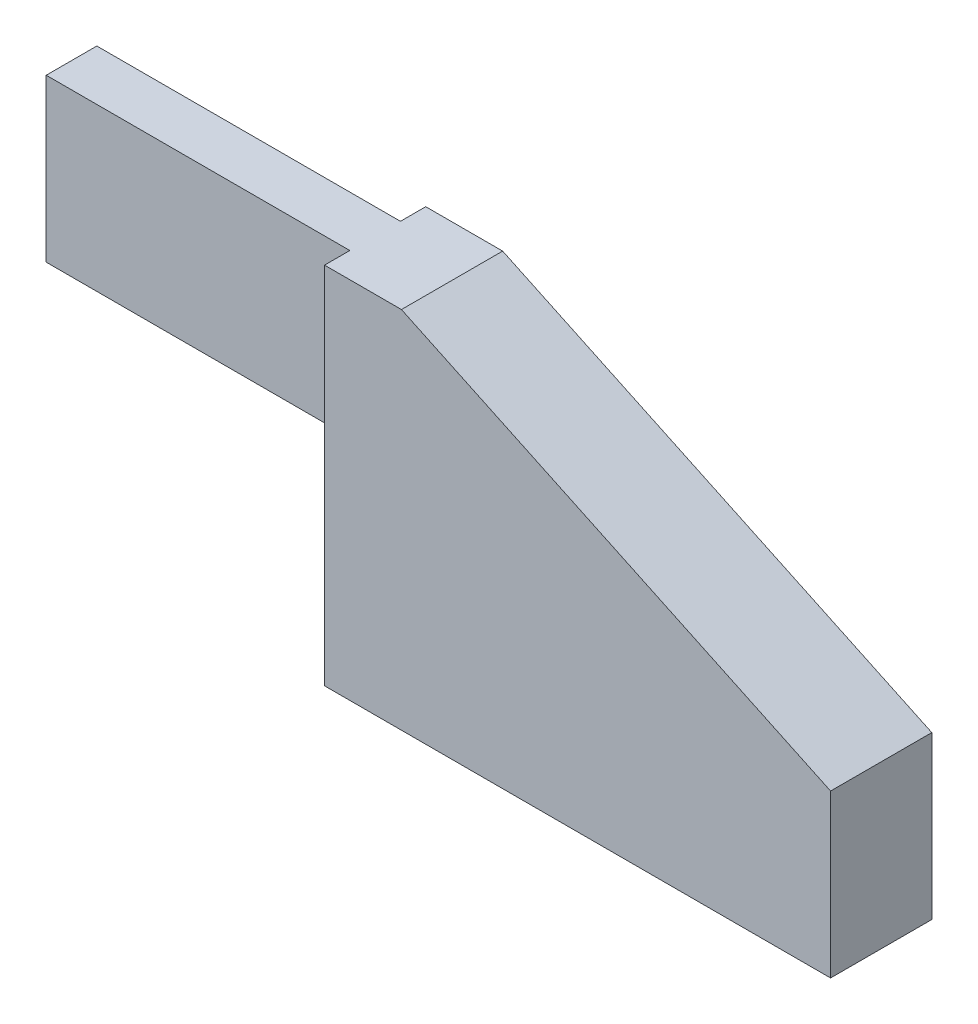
SolidWorks part; units mm, degrees
ref_plane "Front" through (0, 0, 0) normal (0, 0, 1) x (1, 0, 0)
ref_plane "Top" through (0, 0, 0) normal (0, 1, 0) x (1, 0, 0)
ref_plane "Right" through (0, 0, 0) normal (1, 0, 0) x (0, 0, -1)
sketch "Sketch1" plane through (0, 0, 0) normal (0, 0, 1) x (1, 0, 0)
  line L0 (0, 0) -> (-63.5, 0)
  line L1 (-63.5, 0) -> (-63.5, 25.4)
  line L2 (-63.5, 25.4) -> (-101.6, 25.4)
  line L3 (-101.6, 25.4) -> (-101.6, 45.72)
  line L4 (-101.6, 45.72) -> (-53.848, 45.72)
  line L5 (-53.848, 45.72) -> (0, 20.32)
  line L6 (0, 20.32) -> (0, 0)
  dimension "D1" = 63.5
  dimension "D2" = 45.72
  dimension "D3" = 20.32
  dimension "D4" = 101.6
  dimension "D5" = 53.848
  dimension "D6" = 25.4
extrude "Base-Extrude" add sketch "Sketch1" along normal blind 12.7
sketch "Sketch3" plane through (0, 25.4, 0) normal (0, -1, 0) x (1, 0, 0)
  line L0 (-101.6, 12.7) -> (-63.5, 12.7) construction
  line L1 (-101.6, 12.7) -> (-63.5, 12.7)
  line L2 (-101.6, 0) -> (-63.5, 0) construction
  line L3 (-101.6, 0) -> (-63.5, 0)
  line L4 (-101.6, 9.525) -> (-63.5, 9.525)
  line L5 (-101.6, 3.175) -> (-63.5, 3.175)
  line L6 (-63.5, 12.7) -> (-63.5, 0) construction
  line L7 (-101.6, 12.7) -> (-101.6, 0) construction
  line L8 (-63.5, 12.7) -> (-63.5, 9.525)
  line L9 (-101.6, 12.7) -> (-101.6, 9.525)
  line L10 (-101.6, 3.175) -> (-101.6, 0)
  line L11 (-63.5, 3.175) -> (-63.5, 0)
  dimension "D1" = 3.175
  dimension "D2" = 3.175
extrude "Cut-Extrude1" cut sketch "Sketch3" against normal through all
